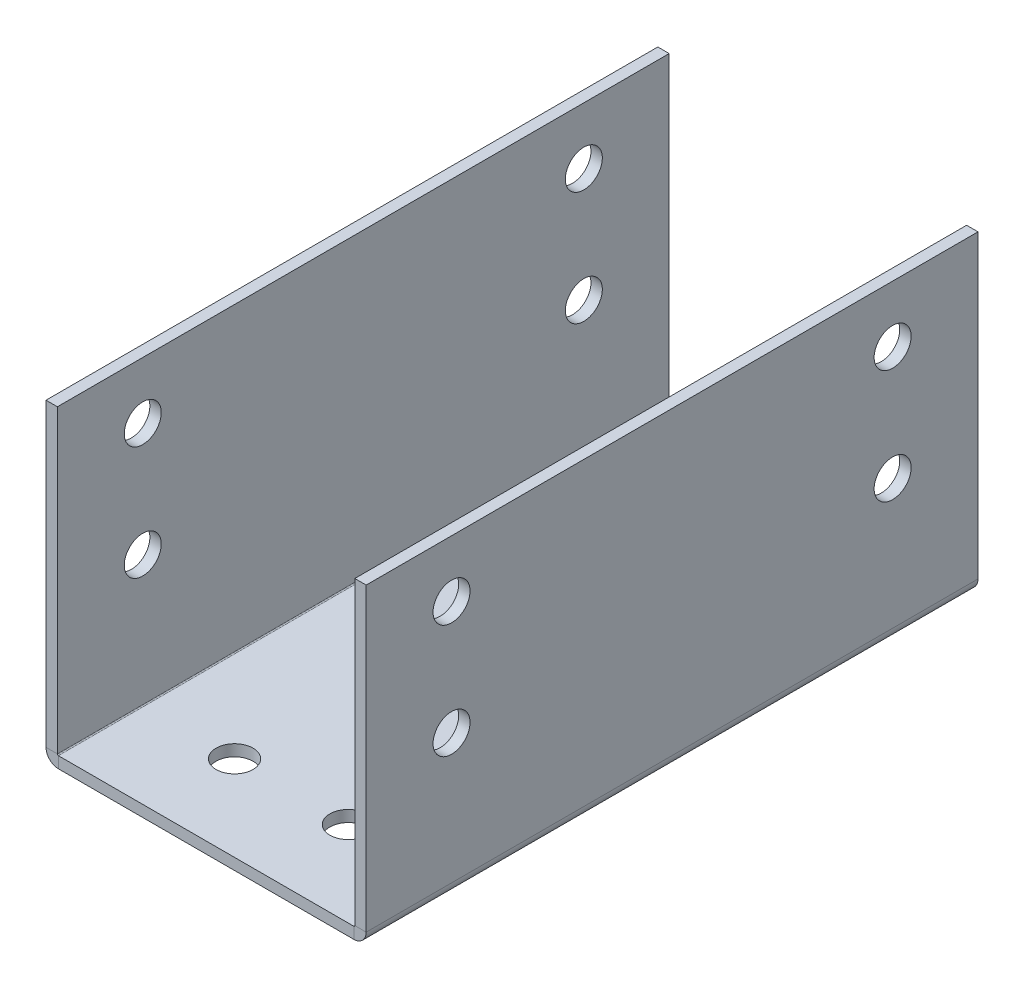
SolidWorks part; units mm, degrees
ref_plane "Front Plane" through (0, 0, 0) normal (0, 0, 1) x (1, 0, 0)
ref_plane "Top Plane" through (0, 0, 0) normal (0, 1, 0) x (1, 0, 0)
ref_plane "Right Plane" through (0, 0, 0) normal (1, 0, 0) x (0, 0, -1)
sketch "Sketch1" plane through (0, 0, 0) normal (0, 1, 0) x (1, 0, 0)
  line L1 (0, 0) -> (-645, 0)
  line L2 (0, 0) -> (0, 430)
  line L3 (0, 430) -> (-645, 430)
  line L4 (-645, 0) -> (-645, 430)
  dimension "D1" = 645
  dimension "D2" = 430
base flange "Base-Flange1" sketch "Sketch1" thickness 8 reverse thickness direction no parameters "D1"=0.7366
sketch "Sketch6" plane through (0, 0, 0) normal (0, 1, 0) x (1, 0, 0)
  line L1 (0, 430) -> (-645, 430) construction
  line L2 (-430, 430) -> (-430, 0)
  line L3 (0, 0) -> (-645, 0) construction
  line L5 (-215, 430) -> (-215, 0)
sketched bend "Sketched Bend1" thickness 8 parameters "D1"=0
bend "SketchBend1" bend radius 0.7366 bend angle 90 parameters "D5"=1
bend "SketchBend2" bend radius 0 bend angle 90 parameters "D5"=2
sketch "Sketch7" plane through (-209.9835, 0, 0) normal (1, 0, 0) x (0, 0, -1)
  line L0 (0, 212.0165) -> (60, 212.0165)
  line L1 (0, 212.0165) -> (430, 212.0165) construction
  line L2 (60, 212.0165) -> (60, 172.0165)
  line L6 (0, 0.7366) -> (430, 0.7366) construction
  circle A0 centre (60, 172.0165) radius 13
  circle A1 centre (370, 172.0165) radius 13
  circle A2 centre (370, 92.0165) radius 13
  circle A3 centre (60, 92.0165) radius 13
  dimension "D1" = 2
  dimension "D6" = 26
  dimension "D3" = 60
  dimension "D4" = 40
  dimension "D5" = 80
  dimension "D7" = 310
  dimension "D8" = 91.2799
  dimension "D2" = 2
extrude "Cut-Extrude1" cut sketch "Sketch7" against normal through all
sketch "Sketch8" plane through (0, -8, 0) normal (0, -1, 0) x (1, 0, 0)
  line L0 (-322.5, 0) -> (-362.5, 0)
  line L1 (0, 0) -> (-645, 0) construction
  line L2 (-362.5, 0) -> (-362.5, -60)
  line L3 (-218.7201, -430) -> (-426.2799, -430) construction
  circle A0 centre (-362.5, -60) radius 13
  circle A1 centre (-282.5, -60) radius 13
  circle A2 centre (-282.5, -370) radius 13
  circle A3 centre (-362.5, -370) radius 13
  dimension "D1" = 2
  dimension "D6" = 26
  dimension "D8" = 60
  dimension "D3" = 80
  dimension "D4" = 60
  dimension "D5" = 310
  dimension "D7" = 40
  dimension "D2" = 2
extrude "Cut-Extrude4" cut sketch "Sketch8" against normal through all contours A1 | A0 | A3 | A2
sketch "Bend-Lines1" [suppressed] plane through (0, 0, 0) normal (0, 1, 0) x (1, 0, 0)
sketch "Bounding-Box1" [suppressed] plane through (0, 0, 0) normal (0, 1, 0) x (1, 0, 0)
sheet metal parameters "Sheet-Metal1" thickness 8 parameters "D1"=0.7366
flat pattern "Flat-Pattern1"
sketch "Bend-Lines2" plane through (-217.9835, 0, 0) normal (-1, 0, 0) x (0, 0, 1)
  line L0 (-430, -2.9835) -> (0, -2.9835) construction
  line L1 (-430, -217.9835) -> (0, -217.9835) construction
  line L2 (-430, -2.9835) -> (0, -2.9835) construction
  line L3 (-430, -217.9835) -> (0, -217.9835) construction
sketch3d "Bounding-Box2" [suppressed]
  line L0 (0, 0, 0) -> (0, -645, 0) construction
  line L1 (-430, 0, 0) -> (-430, -645, 0) construction
  line L2 (0, 0, 0) -> (-430, 0, 0) construction
  line L3 (0, -645, 0) -> (-430, -645, 0) construction
bend of the flat pattern "Flatten-<SketchBend1>1"
bend of the flat pattern "Flatten-<SketchBend2>1"
sheet metal parameters "Sheet-Metal2" thickness 8 parameters "D1"=0.7366
flat pattern "Flat-Pattern1"
sketch "Bend-Lines2" plane through (-217.9835, 0, 0) normal (-1, 0, 0) x (0, 0, 1)
  line L0 (-430, -2.9835) -> (0, -2.9835) construction
  line L1 (-430, -217.9835) -> (0, -217.9835) construction
  line L2 (-430, -2.9835) -> (0, -2.9835) construction
  line L3 (-430, -217.9835) -> (0, -217.9835) construction
sketch3d "Bounding-Box2" [suppressed]
  line L0 (0, 0, 0) -> (0, -645, 0) construction
  line L1 (-430, 0, 0) -> (-430, -645, 0) construction
  line L2 (0, 0, 0) -> (-430, 0, 0) construction
  line L3 (0, -645, 0) -> (-430, -645, 0) construction
bend of the flat pattern "Flatten-<SketchBend1>1"
bend of the flat pattern "Flatten-<SketchBend2>1"
sketch "Sketch8-1" [suppressed] plane through (-209.9835, 212.0165, 0) normal (1, 0, 0) x (0, 1, 0)
  line L0 (-322.5, 0) -> (-362.5, 0)
  line L2 (-362.5, 0) -> (-362.5, -60)
  line L3 (0, -430) -> (-645, -430) construction
  circle A0 centre (-362.5, -60) radius 13
  circle A1 centre (-282.5, -60) radius 13
  circle A2 centre (-282.5, -370) radius 13
  circle A3 centre (-362.5, -370) radius 13
  dimension "D1" = 2
  dimension "D6" = 26
  dimension "D8" = 60
  dimension "D3" = 80
  dimension "D4" = 60
  dimension "D5" = 310
  dimension "D7" = 40
  dimension "D2" = 2
sheet metal parameters "Sheet-Metal3" thickness 8 parameters "D1"=0.7366
flat pattern "Flat-Pattern1"
sketch "Bend-Lines2" plane through (-217.9835, 0, 0) normal (-1, 0, 0) x (0, 0, 1)
  line L0 (-430, -2.9835) -> (0, -2.9835) construction
  line L1 (-430, -217.9835) -> (0, -217.9835) construction
  line L2 (-430, -2.9835) -> (0, -2.9835) construction
  line L3 (-430, -217.9835) -> (0, -217.9835) construction
sketch3d "Bounding-Box2" [suppressed]
  line L0 (0, 0, 0) -> (0, -645, 0) construction
  line L1 (-430, 0, 0) -> (-430, -645, 0) construction
  line L2 (0, 0, 0) -> (-430, 0, 0) construction
  line L3 (0, -645, 0) -> (-430, -645, 0) construction
bend of the flat pattern "Flatten-<SketchBend1>1"
bend of the flat pattern "Flatten-<SketchBend2>1"
sketch "Sketch8-1" [suppressed] plane through (-209.9835, 212.0165, 0) normal (1, 0, 0) x (0, 1, 0)
  line L0 (-322.5, 0) -> (-362.5, 0)
  line L2 (-362.5, 0) -> (-362.5, -60)
  line L3 (0, -430) -> (-645, -430) construction
  circle A0 centre (-362.5, -60) radius 13
  circle A1 centre (-282.5, -60) radius 13
  circle A2 centre (-282.5, -370) radius 13
  circle A3 centre (-362.5, -370) radius 13
  dimension "D1" = 2
  dimension "D6" = 26
  dimension "D8" = 60
  dimension "D3" = 80
  dimension "D4" = 60
  dimension "D5" = 310
  dimension "D7" = 40
  dimension "D2" = 2
